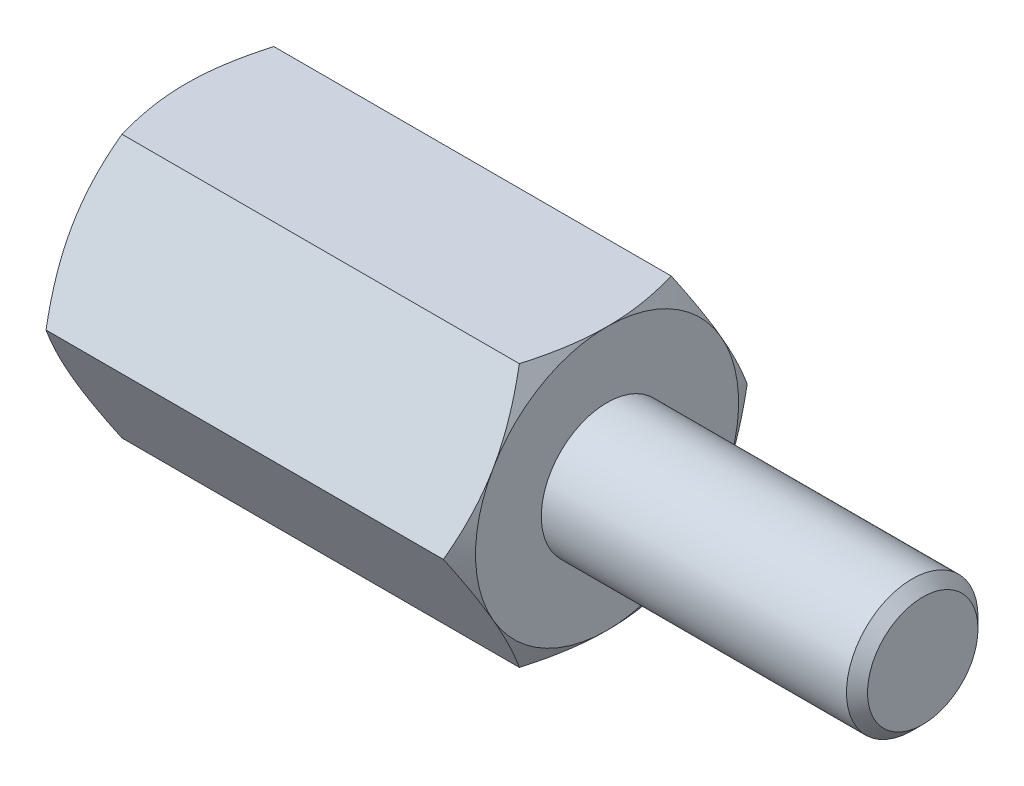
SolidWorks part; units mm, degrees
ref_plane "Front Plane" through (0, 0, 0) normal (0, 0, 1) x (1, 0, 0)
ref_plane "Top Plane" through (0, 0, 0) normal (0, 1, 0) x (1, 0, 0)
ref_plane "Right Plane" through (0, 0, 0) normal (1, 0, 0) x (0, 0, -1)
sketch "Sketch1" plane through (0, 0, 0) normal (1, 0, 0) x (0, 0, -1)
  line L1 (1.4434, 2.5) -> (-1.4434, 2.5)
  line L2 (-1.4434, 2.5) -> (-2.8868, 0)
  line L3 (-2.8868, 0) -> (-1.4434, -2.5)
  line L4 (-1.4434, -2.5) -> (1.4434, -2.5)
  line L5 (1.4434, -2.5) -> (2.8868, 0)
  line L6 (2.8868, 0) -> (1.4434, 2.5)
  circle A0 centre (0, 0) radius 2.5 construction
  dimension "D1" = 5
extrude "Extrude2" add sketch "Sketch1" along normal mid plane 8
sketch "Sketch2" plane through (0, 0, 0) normal (0, 0, 1) x (1, 0, 0)
  line L0 (-4, 2.5) -> (-2.5, 5.0981)
  line L1 (-4, 5.5) -> (-4, 2.5)
  line L3 (0, 0) -> (50000, 0) construction
  arc A0 (-2.5, 5.0981) -> (-4, 5.5) centre (-3.1962, 5.5) ccw
  dimension "D1" = 30
  dimension "D2" = 3
revolve "Cut-Revolve1" cut sketch "Sketch2" angle 360 about L3
mirror "Mirror1" about plane through (0, 0, 0) normal (1, 0, 0) of "Cut-Revolve1"
sketch "Sketch3" plane through (-4, 0, 0) normal (-1, 0, 0) x (0, 0, 1)
  circle A0 centre (0, 0) radius 1.05
  dimension "D1" = 2.1
extrude "Extrude3" cut sketch "Sketch3" against normal blind 5
sketch "Sketch4" plane through (0, 0, 0) normal (0, 0, 1) x (1, 0, 0)
  line L0 (1, 0) -> (1, 1.05)
  line L1 (3.7767, 0) -> (-3.7767, 0) construction
  line L2 (1, 1.05) -> (1.6062, 0)
  line L3 (1.6062, 0) -> (1, 0)
  line L4 (-4, 1.25) -> (-4, -1.25) construction
  point P4 (-4, 0)
  dimension "D1" = 30
  dimension "D2" = 1.05
  dimension "D3" = 5
revolve "Cut-Revolve2" cut sketch "Sketch4" angle 360 about L3
sketch "Sketch5" plane through (4, 0, 0) normal (1, 0, 0) x (0, 0, -1)
  circle A0 centre (0, 0) radius 1.25
  dimension "D1" = 2.5
extrude "Extrude4" add sketch "Sketch5" along normal blind 6
chamfer "Chamfer1" distance 0.2 angle 45 1 edges at (10, 0, -1.25)
equation "\"D2@Sketch4\" = \"D1@Sketch3\"/2"
